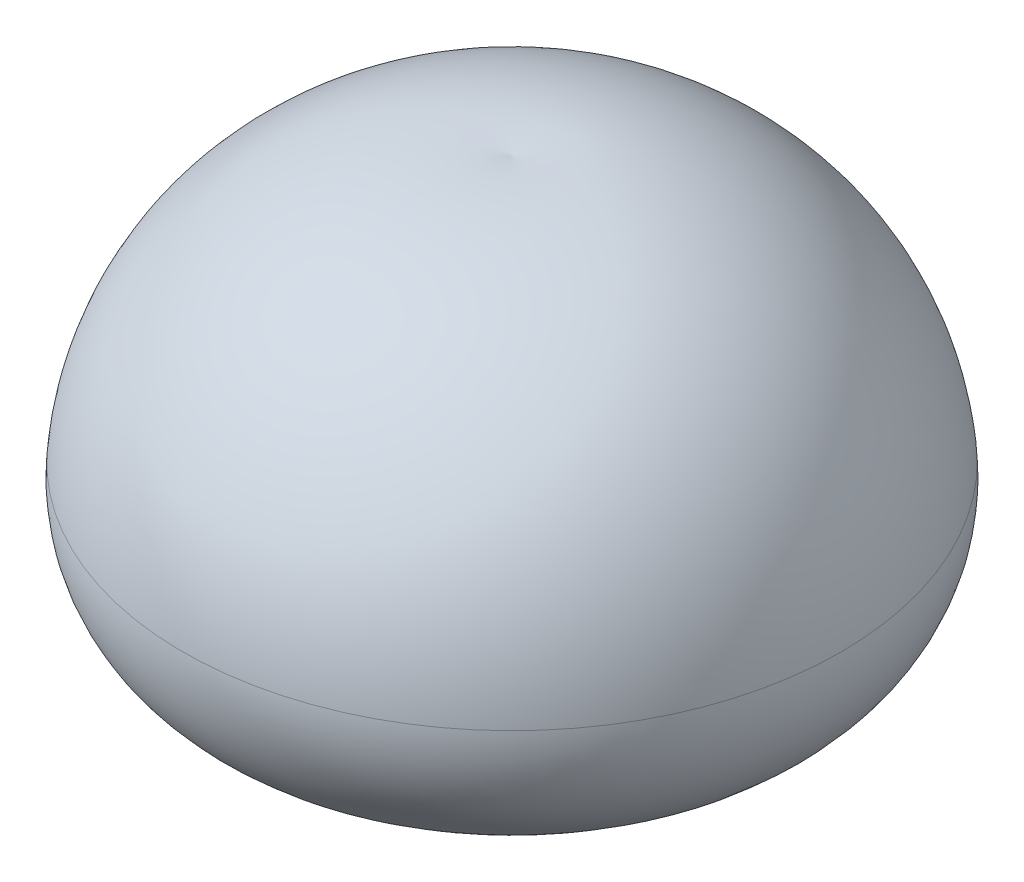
SolidWorks part; units mm, degrees
ref_plane "前视基准面" through (0, 0, 0) normal (0, 0, 1) x (1, 0, 0)
ref_plane "上视基准面" through (0, 0, 0) normal (0, 1, 0) x (1, 0, 0)
ref_plane "右视基准面" through (0, 0, 0) normal (1, 0, 0) x (0, 0, -1)
sketch "草图1" plane through (0, 0, 0) normal (0, 0, 1) x (1, 0, 0)
  line L0 (0, 860.3204) -> (0, -27.1227) construction
  line L1 (-196.265, 0) -> (315.568, 0) construction
  line L2 (300, 645) -> (-726.2401, 1237.5) construction
  line L3 (300, 645) -> (1480.4907, 748.2796) construction
  line L4 (300, 1071.2586) -> (300, 538.1611) construction
  line L5 (1480.4907, 748.2796) -> (1495.7841, 947.694) construction
  line L6 (1495.7841, 947.694) -> (2702.2414, 855.1689) construction
  line L7 (-726.2401, 1237.5) -> (-853.1471, 1082.9212) construction
  line L8 (-853.1471, 1082.9212) -> (-1788.3489, 1850.7088) construction
  line L9 (1480.4907, 748.2796) -> (1532.2545, 555.0944) construction
  line L10 (1532.2545, 555.0944) -> (170.2991, 190.1595) construction
  line L11 (1319.5558, 926.8817) -> (1319.5558, 45.241) construction
  line L12 (1319.5558, 45.241) -> (1296.2796, -86.7648) construction
  line L13 (1319.5558, 45.241) -> (1343.4101, -90.0433) construction
  line L14 (1319.5558, 190.9816) -> (1243.487, 234.8999) construction
  line L15 (1319.5558, 190.9816) -> (1430.874, 200.7207) construction
  line L16 (1319.5558, 372.2851) -> (1233.3752, 340.918) construction
  line L17 (1319.5558, 372.2851) -> (1338.973, 262.165) construction
  line L18 (1319.5558, 631.6387) -> (1370.1273, 492.6947) construction
  line L19 (1319.5558, 631.6387) -> (1271.182, 498.7326) construction
  line L20 (1319.5558, 817.0834) -> (1182.6552, 680.1828) construction
  line L21 (1319.5558, 817.0834) -> (1471.4957, 665.1436) construction
  line L22 (-726.2401, 1237.5) -> (-529.2786, 1202.7704) construction
  line L23 (-529.2786, 1202.7704) -> (-739.3928, 11.153) construction
  line L24 (-726.2401, 1237.5) -> (-657.8361, 1425.4385) construction
  line L25 (-657.8361, 1425.4385) -> (479.192, 1011.5942) construction
  line L26 (1480.4907, 748.2796) -> (1299.2292, 663.7559) construction
  line L27 (1299.2292, 663.7559) -> (787.8611, 1760.3883) construction
  line L29 (0, 1824.8727) -> (0, 3037.6836)
  arc A0 (2702.2414, 855.1689) -> (363.4843, 241.9233) centre (1480.4907, 748.2796) cw
  arc A1 (2702.2414, 855.1689) -> (0, 3037.6836) centre (300, 645) ccw
  arc A2 (0, 1824.8727) -> (329.2312, 1862.0641) centre (300, 645) cw
  arc A4 (363.4843, 241.9233) -> (479.192, 1011.5942) centre (300, 645) ccw
  arc A5 (479.192, 1011.5942) -> (329.2312, 1862.0641) centre (-726.2401, 1237.5) ccw
  point P5 (300, 645)
  point P6 (300, 1830)
  point P7 (1510, 2030)
  point P8 (1750, 2030)
  point P14 (430, 2030)
  dimension "D1" = 200
  dimension "L12x" = 300
  dimension "D2" = 1210
  dimension "L23z" = 1185
  dimension "D3" = 170
  dimension "L12z" = 645
  dimension "D4" = 170
  dimension "L34mx" = 200
  dimension "D5" = 60
  dimension "L56z" = 240
  dimension "D6" = 85
  dimension "L35z" = 1210
  dimension "D7" = 85
  dimension "D8" = 60
  dimension "D9" = 1185
  dimension "L34z" = 130
  dimension "L45z" = 1080
  dimension "D10" = 110
  dimension "D11" = 170
  dimension "D12" = 200
  dimension "D13" = 200
  dimension "D14" = 135
  dimension "D15" = 135
  dimension "D16" = 260
  dimension "D17" = 20
  dimension "D18" = 260
  dimension "D19" = 20
sketch "草图2" plane through (0, 0, 0) normal (0, 0, 1) x (1, 0, 0)
  line L0 (0, 860.3204) -> (0, -27.1227) construction
  line L1 (-196.265, 0) -> (315.568, 0) construction
  line L2 (300, 645) -> (-726.2401, 1237.5) construction
  line L3 (300, 645) -> (1480.4907, 748.2796) construction
  line L4 (300, 1071.2586) -> (300, 538.1611) construction
  line L5 (1480.4907, 748.2796) -> (1495.7841, 947.694) construction
  line L6 (1495.7841, 947.694) -> (2702.2414, 855.1689) construction
  line L7 (-726.2401, 1237.5) -> (-853.1471, 1082.9212) construction
  line L8 (-853.1471, 1082.9212) -> (-1788.3489, 1850.7088) construction
  line L9 (1480.4907, 748.2796) -> (1532.2545, 555.0944) construction
  line L10 (1532.2545, 555.0944) -> (170.2991, 190.1595) construction
  line L11 (1319.5558, 926.8817) -> (1319.5558, 45.241) construction
  line L12 (1319.5558, 45.241) -> (1296.2796, -86.7648) construction
  line L13 (1319.5558, 45.241) -> (1343.4101, -90.0433) construction
  line L14 (1319.5558, 190.9816) -> (1243.487, 234.8999) construction
  line L15 (1319.5558, 190.9816) -> (1430.874, 200.7207) construction
  line L16 (1319.5558, 372.2851) -> (1233.3752, 340.918) construction
  line L17 (1319.5558, 372.2851) -> (1338.973, 262.165) construction
  line L18 (1319.5558, 631.6387) -> (1370.1273, 492.6947) construction
  line L19 (1319.5558, 631.6387) -> (1271.182, 498.7326) construction
  line L20 (1319.5558, 817.0834) -> (1182.6552, 680.1828) construction
  line L21 (1319.5558, 817.0834) -> (1471.4957, 665.1436) construction
  line L22 (-726.2401, 1237.5) -> (-529.2786, 1202.7704) construction
  line L23 (-529.2786, 1202.7704) -> (-739.3928, 11.153) construction
  line L24 (-726.2401, 1237.5) -> (-657.8361, 1425.4385) construction
  line L25 (-657.8361, 1425.4385) -> (479.192, 1011.5942) construction
  line L26 (1480.4907, 748.2796) -> (1299.2292, 663.7559) construction
  line L27 (1299.2292, 663.7559) -> (787.8611, 1760.3883) construction
  line L29 (0, 1824.8727) -> (0, 3037.6836)
  arc A1 (0, 3037.6836) -> (-1788.3489, 1850.7088) centre (300, 645) ccw
  arc A2 (-1788.3489, 1850.7088) -> (-739.3928, 11.153) centre (-726.2401, 1237.5) ccw
  arc A3 (-739.3928, 11.153) -> (0, 1824.8727) centre (300, 645) cw
  point P5 (300, 645)
  point P6 (300, 1830)
  point P7 (1510, 2030)
  point P8 (1750, 2030)
  point P14 (430, 2030)
  dimension "D1" = 200
  dimension "D2" = 1210
  dimension "L23z" = 1185
  dimension "D3" = 170
  dimension "D4" = 170
  dimension "L34mx" = 200
  dimension "D5" = 60
  dimension "L56z" = 240
  dimension "D6" = 85
  dimension "L35z" = 1210
  dimension "D7" = 85
  dimension "D8" = 60
  dimension "D9" = 1185
  dimension "L34z" = 130
  dimension "L45z" = 1080
  dimension "D10" = 110
  dimension "D11" = 170
  dimension "D12" = 200
  dimension "D13" = 200
  dimension "D14" = 135
  dimension "D15" = 135
  dimension "D16" = 260
  dimension "D17" = 20
  dimension "D18" = 260
  dimension "D19" = 20
revolve "旋转1" add sketch "草图1" angle 360 mid plane about L29
revolve "旋转2" add sketch "草图2" angle 360 mid plane about L29
equation "\"D9@草图1\" = \"L23z@草图1\""
equation "\"D1@草图1\" = \"L34mx@草图1\""
equation "\"D2@草图1\" = \"L35z@草图1\""
equation "\"D7@草图1\" = \"D6@草图1\""
equation "\"D8@草图1\" = \"D5@草图1\""
equation "\"D16@草图1\" = \"D11@草图1\"+90"
equation "\"D17@草图1\" = \"D10@草图1\"-90"
equation "\"D18@草图1\" = \"D11@草图1\"+90"
equation "\"D19@草图1\" = \"D10@草图1\"-90"
